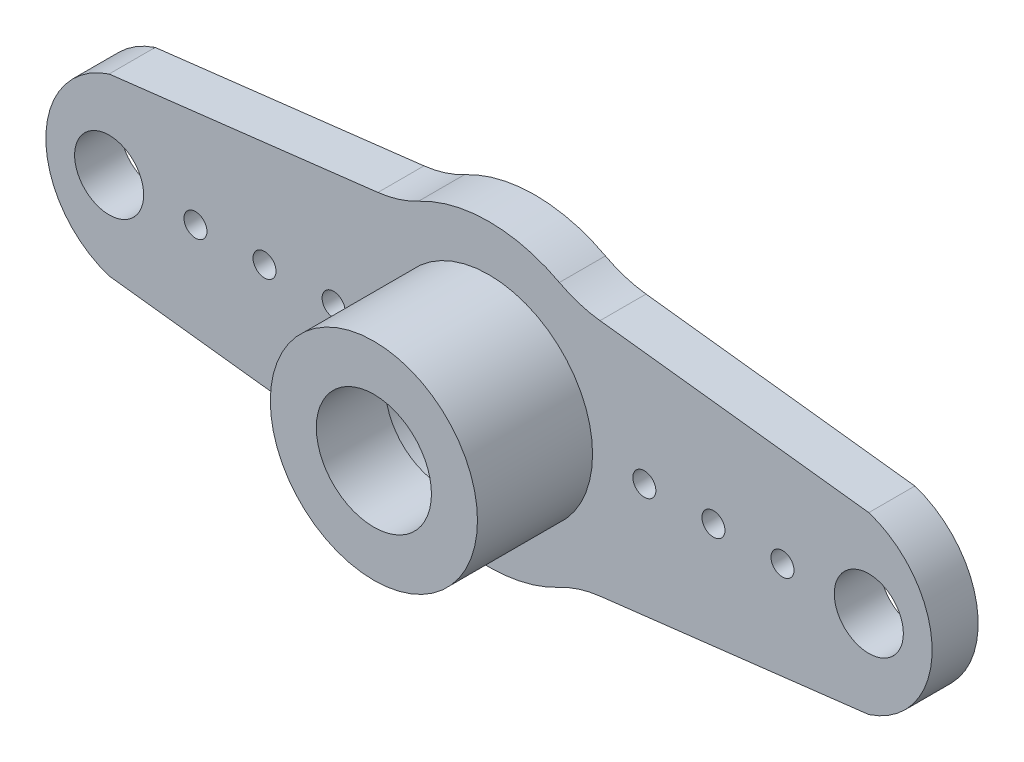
SolidWorks part; units mm, degrees
ref_plane "前视" through (0, 0, 0) normal (0, 0, 1) x (1, 0, 0)
ref_plane "上视" through (0, 0, 0) normal (0, 1, 0) x (1, 0, 0)
ref_plane "右视" through (0, 0, 0) normal (1, 0, 0) x (0, 0, -1)
sketch "草图1" plane through (0, 0, 0) normal (0, 0, 1) x (1, 0, 0)
  line L1 (0, 0) -> (-33, 0) construction
  line L2 (0, 0) -> (0, -12.3019) construction
  line L3 (16.5, -3.7997) -> (4.8232, -5.1821)
  line L4 (16.5, 3.7997) -> (4.8232, 5.1821)
  line L6 (1.5, 0) -> (33, 0) construction
  line L7 (-16.5, -3.7997) -> (-4.8232, -5.1821)
  line L8 (-16.5, 3.7997) -> (-4.8232, 5.1821)
  arc A0 (-4.8232, 5.1821) -> (-3.0584, 5.7355) centre (-5.411, 10.1475) ccw
  arc A1 (-16.5, 3.7997) -> (-16.5, -3.7997) centre (-15.25, 0) ccw
  arc A2 (16.5, 3.7997) -> (16.5, -3.7997) centre (15.25, 0) cw
  arc A3 (3.0584, 5.7355) -> (-3.0584, 5.7355) centre (0, 0) ccw
  arc A4 (-3.0584, -5.7355) -> (3.0584, -5.7355) centre (0, 0) ccw
  circle A5 centre (-16.5, 0) radius 0.5
  circle A6 centre (-12.75, 0) radius 0.5
  circle A7 centre (-9.75, 0) radius 0.5
  circle A8 centre (-6.75, 0) radius 0.5
  circle A9 centre (-3.75, 0) radius 0.5
  circle A10 centre (3.75, 0) radius 0.5
  circle A11 centre (6.75, 0) radius 0.5
  circle A12 centre (9.75, 0) radius 0.5
  circle A13 centre (12.75, 0) radius 0.5
  circle A14 centre (16.5, 0) radius 0.5
  arc A15 (3.0584, 5.7355) -> (4.8232, 5.1821) centre (5.411, 10.1475) ccw
  arc A16 (3.0584, -5.7355) -> (4.8232, -5.1821) centre (5.411, -10.1475) cw
  arc A17 (-4.8232, -5.1821) -> (-3.0584, -5.7355) centre (-5.411, -10.1475) cw
  point P14 (-3.75, 5.3092)
  point P41 (3.75, 5.3092)
  point P44 (3.75, -5.3092)
  point P47 (-3.75, -5.3092)
  dimension "D1" = 6.5
  dimension "D2" = 8
  dimension "D3" = 38.5
  dimension "D4" = 1
  dimension "D5" = 33
  dimension "D6" = 3
  dimension "D7" = 3
  dimension "D8" = 3
  dimension "D9" = 3.75
  dimension "D10" = 7.5
  dimension "D11" = 5
extrude "凸台-拉伸1" add sketch "草图1" along normal blind 2
sketch "草图2" plane through (0, 0, 2) normal (0, 0, 1) x (1, 0, 0)
  circle A0 centre (0, 0) radius 4.5
  circle A1 centre (0, 0) radius 2.5
  dimension "D1" = 9
  dimension "D2" = 5
extrude "凸台-拉伸2" add sketch "草图2" along normal blind 5
sketch "草图3" plane through (0, 0, 0) normal (0, 0, -1) x (-1, 0, 0)
  circle A0 centre (0, 0) radius 3.5
  dimension "D1" = 7
extrude "切除-拉伸1" cut sketch "草图3" against normal blind 4
sketch "草图4" plane through (0, 0, 0) normal (0, 0, -1) x (-1, 0, 0)
  line L0 (19.25, 0) -> (-19.25, 0)
  arc A0 (16.5, -3.7997) -> (16.5, 3.7997) centre (15.25, 0) ccw construction
  arc A1 (-16.5, 3.7997) -> (-16.5, -3.7997) centre (-15.25, 0) ccw construction
sketch "草图5" plane through (0, 0, 2) normal (0, 0, 1) x (1, 0, 0)
  circle A0 centre (16.5, 0) radius 1.5
  circle A1 centre (-16.5, 0) radius 1.5
  dimension "D1" = 3
  dimension "D2" = 3
extrude "切除-拉伸2" cut sketch "草图5" against normal blind 10
